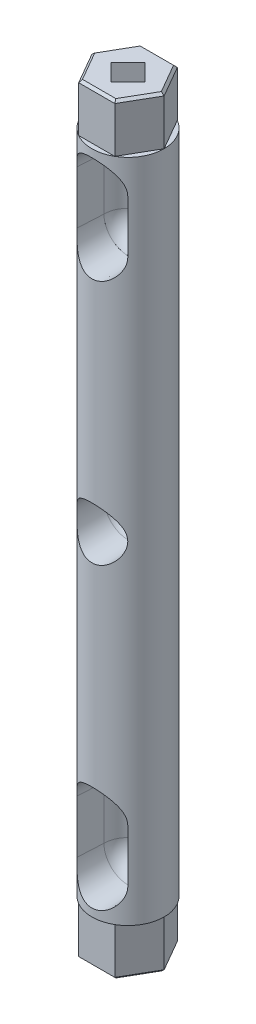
SolidWorks part; units mm, degrees
ref_plane "Front Plane" through (0, 0, 0) normal (0, 0, 1) x (1, 0, 0)
ref_plane "Top Plane" through (0, 0, 0) normal (0, 1, 0) x (1, 0, 0)
ref_plane "Right Plane" through (0, 0, 0) normal (1, 0, 0) x (0, 0, -1)
sketch "Sketch1" plane through (0, 0, 0) normal (0, 1, 0) x (1, 0, 0)
  circle A0 centre (0, 0) radius 7.5
extrude "Boss-Extrude1" add sketch "Sketch1" along normal blind 138.16
sketch "Sketch2" plane through (0, 0, 0) normal (0, 0, 1) x (1, 0, 0)
  line L0 (0, 138.16) -> (0, 131.16) construction
  line L1 (7.5, 138.16) -> (-7.5, 138.16) construction
  line L2 (0, 0) -> (0, 7) construction
  line L3 (0, 7) -> (0, 131.16) construction
  line L4 (0, 131.16) -> (0, 121.16) construction
  line L5 (-5, 131.16) -> (-5, 121.16)
  line L6 (5, 131.16) -> (5, 121.16)
  line L7 (0, 7) -> (0, 17) construction
  line L8 (-5, 17) -> (-5, 7)
  line L9 (5, 17) -> (5, 7)
  line L10 (0, 121.16) -> (0, 120.16) construction
  line L11 (5, 121.16) -> (5, 120.16)
  line L12 (-5, 121.16) -> (-5, 120.16)
  line L13 (0, 17) -> (0, 18) construction
  line L14 (5, 17) -> (5, 18)
  line L15 (-5, 18) -> (-5, 17)
  arc A0 (5, 131.16) -> (-5, 131.16) centre (0, 131.16) ccw
  circle A1 centre (0, 69.08) radius 5
  arc A2 (-5, 7) -> (5, 7) centre (0, 7) ccw
  arc A3 (5, 18) -> (-5, 18) centre (0, 18) ccw
  arc A5 (-5, 120.16) -> (5, 120.16) centre (0, 120.16) ccw
  dimension "D1" = 10
  dimension "D2" = 1
  dimension "D3" = 1
extrude "Cut-Extrude1" cut sketch "Sketch2" along normal through all draft 3
ref_axis "Axis1" through (0, 138.16, 0) along (0, -1, 0)
sketch "Sketch3" plane through (0, 0, 0) normal (0, 0, 1) x (1, 0, 0)
  line L0 (0, 11) -> (0, 2)
  line L1 (0, 74.08) -> (0, 64.08)
  line L2 (0, 136.16) -> (0, 130)
  line L3 (0, 131.16) -> (0, 120.1675) construction
  line L4 (5, 131.16) -> (5, 120.1675)
  line L5 (0, 130) -> (0, 115.1675)
  line L6 (0, 11) -> (0, 23)
  line L7 (5, 18) -> (5, 7)
  line L8 (-5, 120.66) -> (5, 120.66) construction
  line L9 (-5, 18) -> (5, 18) construction
  line L10 (-5, 120.16) -> (5, 120.16) construction
  arc A0 (5, 131.16) -> (0, 136.16) centre (0, 131.16) ccw
  arc A1 (0, 64.08) -> (0, 74.08) centre (0, 69.08) ccw
  arc A2 (0, 2) -> (5, 7) centre (0, 7) ccw
  arc A3 (0, 115.1675) -> (5, 120.1675) centre (0, 120.1675) ccw
  arc A4 (5, 18) -> (0, 23) centre (0, 18) ccw
  arc A5 (5, 18) -> (-5, 18) centre (0, 18) ccw construction
revolve "Cut-Revolve1" cut sketch "Sketch3" angle 360 about axis through (0, 138.16, 0) along (0, -1, 0)
sketch "Sketch4" plane through (0, 138.16, 0) normal (0, 1, 0) x (1, 0, 0)
  line L1 (7.5, 0) -> (3.75, 6.4952)
  line L2 (3.75, 6.4952) -> (-3.75, 6.4952)
  line L3 (-3.75, 6.4952) -> (-7.5, 0)
  line L4 (-7.5, 0) -> (-3.75, -6.4952)
  line L5 (-3.75, -6.4952) -> (3.75, -6.4952)
  line L6 (3.75, -6.4952) -> (7.5, 0)
  circle A0 centre (0, 0) radius 6.4952 construction
extrude "Boss-Extrude2" add sketch "Sketch4" along normal blind 10
sketch "Sketch5" plane through (0, 0, 0) normal (0, -1, 0) x (-1, 0, 0)
  line L1 (-7.5, 0) -> (-3.75, -6.4952)
  line L2 (-3.75, -6.4952) -> (3.75, -6.4952)
  line L3 (3.75, -6.4952) -> (7.5, 0)
  line L4 (7.5, 0) -> (3.75, 6.4952)
  line L5 (3.75, 6.4952) -> (-3.75, 6.4952)
  line L6 (-3.75, 6.4952) -> (-7.5, 0)
  circle A0 centre (0, 0) radius 6.4952 construction
extrude "Boss-Extrude3" add sketch "Sketch5" along normal blind 10
hole_wizard "#10 (0.1935) Diameter Hole1" positions "Sketch7" profile "Sketch6" hole size "#10" standard "ANSI Inch"
sketch "Sketch7" plane through (0, 148.16, 0) normal (0, 1, 0) x (1, 0, 0)
  point P0 (0, 0)
sketch "Sketch6" plane through (0, 148.16, 0) normal (1, 0, 0) x (0, 0, 1)
  line L0 (0, 0) -> (0, 6.4766)
  line L1 (0, 6.4766) -> (2.4574, 5)
  line L2 (2.4574, 5) -> (2.4574, 0)
  line L5 (2.4574, 0) -> (0, 0)
  line L10 (0, 6.4766) -> (-2.4574, 5) construction
  line L11 (0, -6.35) -> (0, 107.95) construction
  dimension "Hole Dia." = 4.9149
  dimension "Hole Depth" = 5
  dimension "Drill Angle" = 118
hole_wizard "#10 (0.1935) Diameter Hole2" positions "Sketch10" profile "Sketch9" hole size "#10" standard "ANSI Inch"
sketch "Sketch10" plane through (0, -10, 0) normal (0, -1, 0) x (-1, 0, 0)
  point P0 (0, 0)
sketch "Sketch9" plane through (0, -10, 0) normal (1, 0, 0) x (0, 0, -1)
  line L0 (0, 0) -> (0, 6.4766)
  line L1 (0, 6.4766) -> (2.4574, 5)
  line L2 (2.4574, 5) -> (2.4574, 0)
  line L5 (2.4574, 0) -> (0, 0)
  line L10 (0, 6.4766) -> (-2.4574, 5) construction
  line L11 (0, -6.35) -> (0, 107.95) construction
  dimension "Hole Dia." = 4.9149
  dimension "Hole Depth" = 5
  dimension "Drill Angle" = 118
sketch "Sketch11" plane through (0, 148.16, 0) normal (0, 1, 0) x (1, 0, 0)
  line L0 (0, 4.4419) -> (0, -4.4225) construction
  line L1 (-4.1212, 0) -> (4.1989, 0) construction
  line L2 (0, 3.4876) -> (3.4876, 0) construction
  line L3 (0, 3.4876) -> (3.4876, 0)
  line L4 (3.4876, 0) -> (0, -3.4876)
  line L5 (0, -3.4876) -> (-3.4876, 0)
  line L6 (-3.4876, 0) -> (0, 3.4876)
  circle A0 centre (0, 0) radius 2.4574 construction
extrude "Cut-Extrude2" cut sketch "Sketch11" against normal blind 10
sketch "Sketch12" plane through (0, -10, 0) normal (0, -1, 0) x (-1, 0, 0)
  line L0 (0, -3.4876) -> (-3.4876, 0)
  line L1 (-3.4876, 0) -> (0, 3.4876)
  line L2 (0, 3.4876) -> (3.4876, 0)
  line L3 (3.4876, 0) -> (0, -3.4876)
extrude "Cut-Extrude3" cut sketch "Sketch12" against normal blind 10
chamfer "Chamfer1" distance 0.5 angle 45 6 edges at (0, 148.16, 6.4952) (-5.625, 148.16, 3.2476) (-5.625, 148.16, -3.2476) (0, 148.16, -6.4952) (5.625, 148.16, -3.2476) (5.625, 148.16, 3.2476)
chamfer "Chamfer2" distance 0.5 angle 45 6 edges at (-5.625, -10, 3.2476) (-5.625, -10, -3.2476) (0, -10, -6.4952) (5.625, -10, -3.2476) (5.625, -10, 3.2476) (0, -10, 6.4952)
